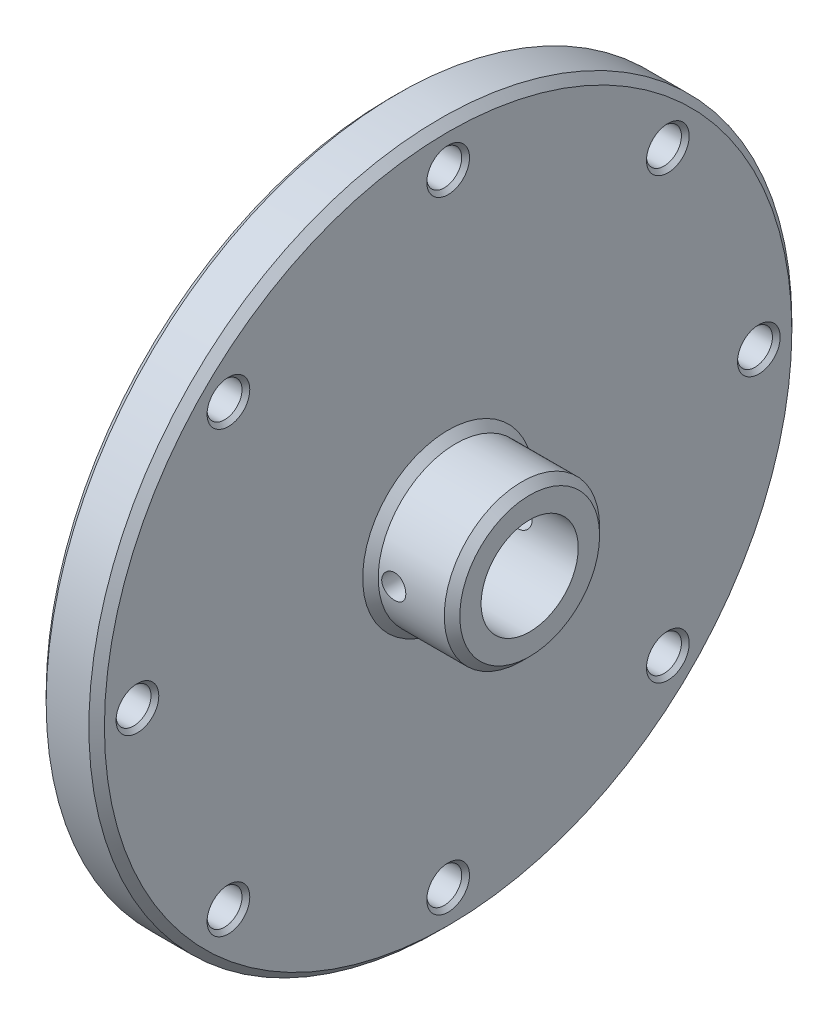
SolidWorks part; units mm, degrees
ref_plane "Plan de face" through (0, 0, 0) normal (0, 0, 1) x (1, 0, 0)
ref_plane "Plan de dessus" through (0, 0, 0) normal (0, 1, 0) x (1, 0, 0)
ref_plane "Plan de droite" through (0, 0, 0) normal (1, 0, 0) x (0, 0, -1)
sketch "Esquisse1" plane through (0, 0, 0) normal (0, 0, 1) x (1, 0, 0)
  line L0 (-4.7169, 0) -> (2.5, 12.5)
  line L1 (-7.5, 90.5) -> (7.5, 90.5)
  line L2 (-7.5, 90.5) -> (-7.5, 0)
  line L3 (-7.5, 0) -> (-4.7169, 0)
  line L4 (7.5, 90.5) -> (7.5, 20)
  line L5 (7.5, 20) -> (28.5, 20)
  line L6 (37.8333, 0) -> (-36.4895, 0) construction
  line L7 (2.5, 12.5) -> (28.5, 12.5)
  line L8 (28.5, 20) -> (28.5, 12.5)
  dimension "D1" = 60
  dimension "D2" = 12.5
  dimension "D3" = 7.5
  dimension "D4" = 21
  dimension "D5" = 15
  dimension "D6" = 90.5
  dimension "D7" = 26
  dimension "D8" = 7.5
revolve "Révolution1" add sketch "Esquisse1" angle 360 about L6
chamfer "Chanfrein1" distance 2 angle 45 4 edges at (7.5, 0, -90.5) (-7.5, 0, -90.5) (7.5, 0, -20) (28.5, 0, -20)
sketch "Esquisse2" plane through (0, 0, 0) normal (0, 0, 1) x (1, 0, 0)
  line L0 (28.5, -18) -> (28.5, 18) construction
  circle A0 centre (13.5, 0) radius 3.1
  dimension "D1" = 6.2
  dimension "D2" = 15
extrude "Enlèv. mat.-Extru.1" cut sketch "Esquisse2" against normal through all and the other way through all
sketch "Esquisse3" plane through (7.5, 0, 0) normal (1, 0, 0) x (0, 0, -1)
  circle A0 centre (0, 80) radius 4.5
  dimension "D1" = 9
  dimension "D2" = 80
extrude "Enlèv. mat.-Extru.2" cut sketch "Esquisse3" against normal through all
chamfer "Chanfrein2" distance 1 angle 45 1 edges at (7.5, 80, -4.5)
pattern_circular "Répétition circulaire1" count 8 over 360 about axis through (0, 0, 0) along (1, 0, 0) of "Chanfrein2", "Enlèv. mat.-Extru.2"
